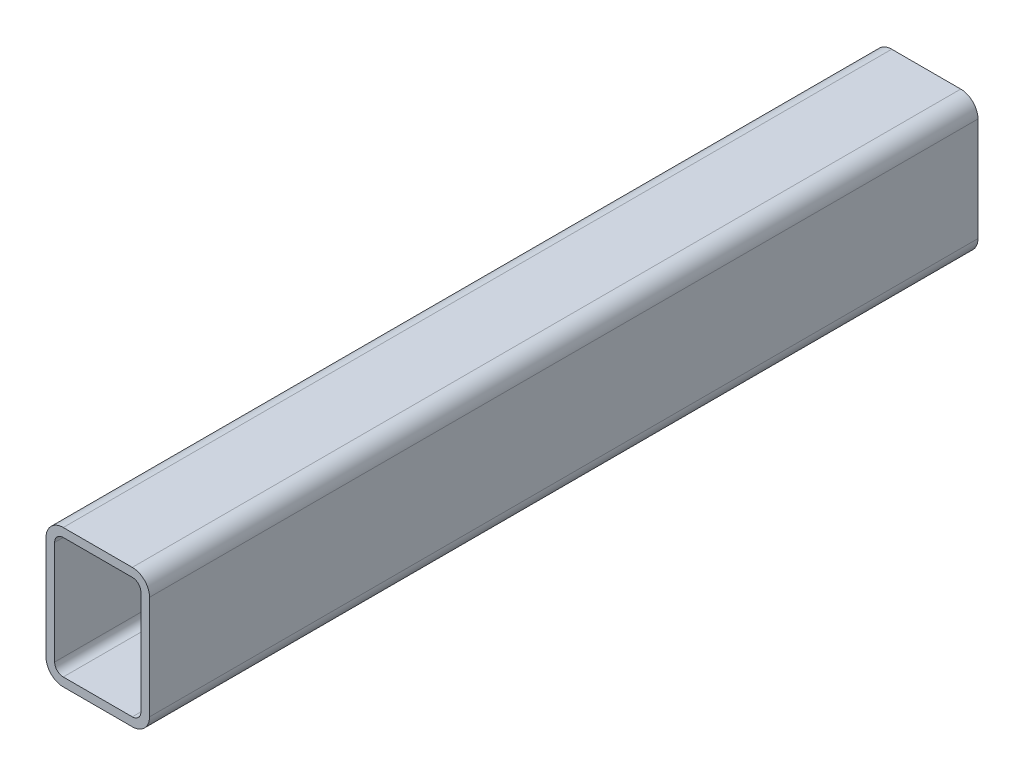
SolidWorks part; units mm, degrees
ref_plane "Front Plane" through (0, 0, 0) normal (0, 0, 1) x (1, 0, 0)
ref_plane "Top Plane" through (0, 0, 0) normal (0, 1, 0) x (1, 0, 0)
ref_plane "Right Plane" through (0, 0, 0) normal (1, 0, 0) x (0, 0, -1)
sketch "Sketch1" plane through (0, 0, 0) normal (0, 0, 1) x (1, 0, 0)
  line B0 (6.35, 50.8) -> (31.75, 50.8)
  arc B1 (38.1, 44.45) -> (31.75, 50.8) centre (31.75, 44.45) ccw
  line B2 (38.1, 44.45) -> (38.1, 6.35)
  arc B3 (31.75, 0) -> (38.1, 6.35) centre (31.75, 6.35) ccw
  line B4 (31.75, 0) -> (6.35, 0)
  arc B5 (0, 6.35) -> (6.35, 0) centre (6.35, 6.35) ccw
  line B6 (0, 6.35) -> (0, 44.45)
  arc B7 (6.35, 50.8) -> (0, 44.45) centre (6.35, 44.45) ccw
  line B8 (6.35, 47.625) -> (31.75, 47.625)
  arc B9 (34.925, 44.45) -> (31.75, 47.625) centre (31.75, 44.45) ccw
  line B10 (34.925, 44.45) -> (34.925, 6.35)
  arc B11 (31.75, 3.175) -> (34.925, 6.35) centre (31.75, 6.35) ccw
  line B12 (31.75, 3.175) -> (6.35, 3.175)
  arc B13 (3.175, 6.35) -> (6.35, 3.175) centre (6.35, 6.35) ccw
  line B14 (3.175, 6.35) -> (3.175, 44.45)
  arc B15 (6.35, 47.625) -> (3.175, 44.45) centre (6.35, 44.45) ccw
sketch_block_instance "HSS2x1.5x0.125-1"
sketch_block "HSS2x1.5x0.125"
extrude "Boss-Extrude1" add sketch "Sketch1" along normal blind 304.8
